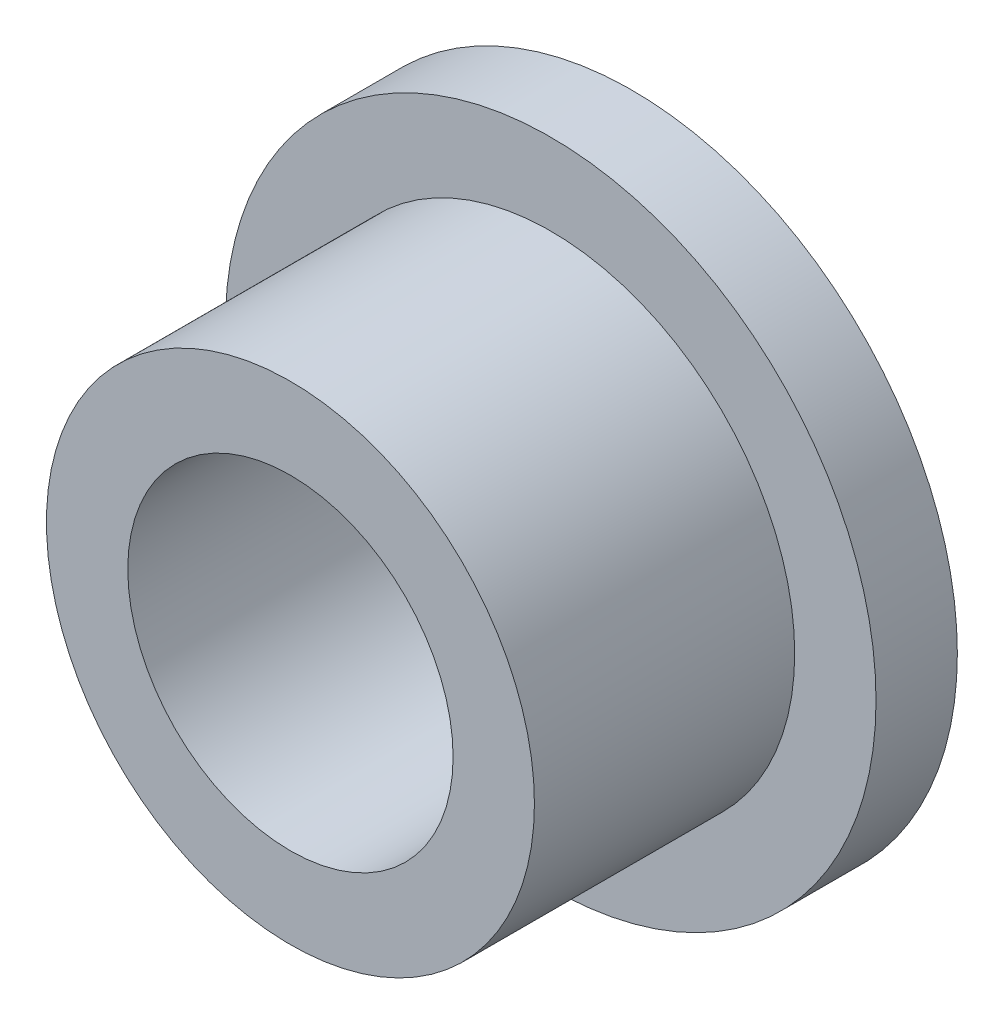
SolidWorks part; units mm, degrees
ref_plane "Front Plane" through (0, 0, 0) normal (0, 0, 1) x (1, 0, 0)
ref_plane "Top Plane" through (0, 0, 0) normal (0, 1, 0) x (1, 0, 0)
ref_plane "Right Plane" through (0, 0, 0) normal (1, 0, 0) x (0, 0, -1)
sketch "Sketch1" plane through (0, 0, 0) normal (0, 0, 1) x (1, 0, 0)
  circle A0 centre (0, 0) radius 6.35
  dimension "D1" = 12.7
extrude "Boss-Extrude1" add sketch "Sketch1" along normal blind 1.5875
sketch "Sketch2" plane through (0, 0, 1.5875) normal (0, 0, 1) x (1, 0, 0)
  circle A0 centre (0, 0) radius 4.7625
  dimension "D1" = 9.525
extrude "Boss-Extrude2" add sketch "Sketch2" along normal blind 5.08
sketch "Sketch3" plane through (0, 0, 6.6675) normal (0, 0, 1) x (1, 0, 0)
  circle A0 centre (0, 0) radius 3.175
  dimension "D1" = 6.35
extrude "Cut-Extrude1" cut sketch "Sketch3" against normal through all
